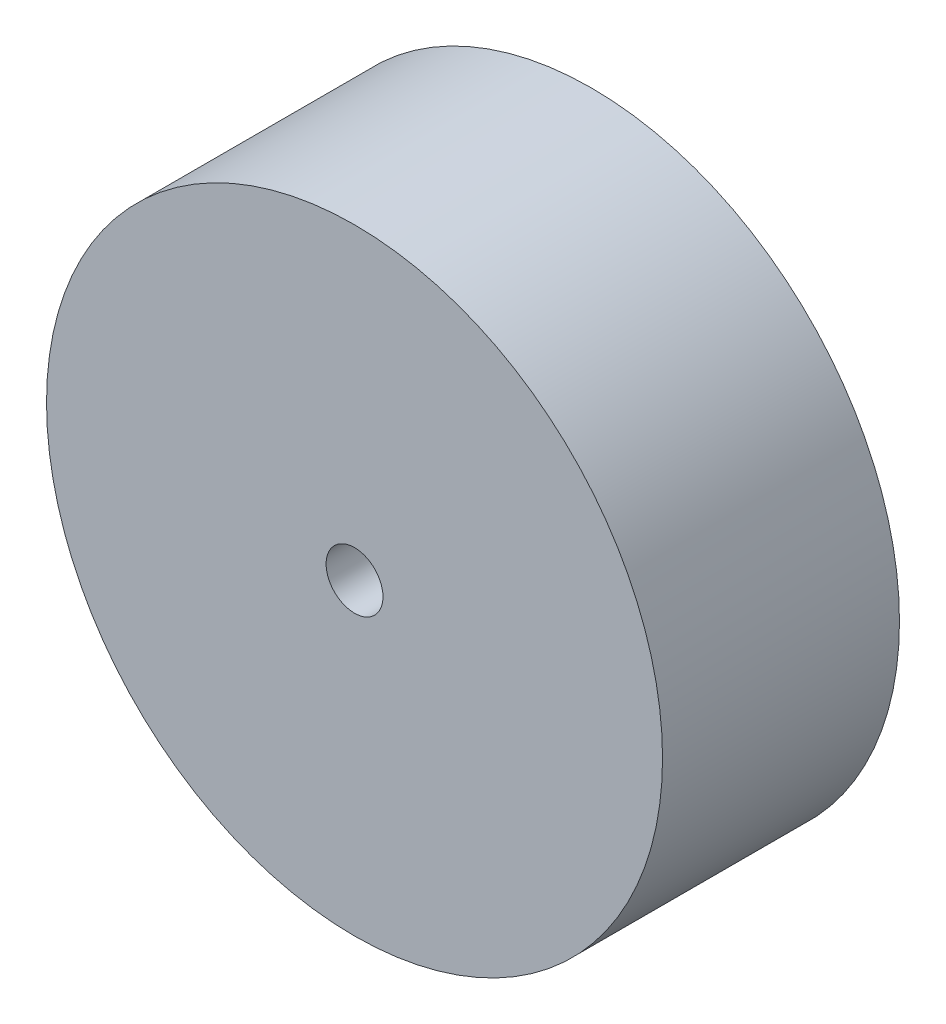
SolidWorks part; units mm, degrees
ref_plane "Plan de face" through (0, 0, 0) normal (0, 0, 1) x (1, 0, 0)
ref_plane "Plan de dessus" through (0, 0, 0) normal (0, 1, 0) x (1, 0, 0)
ref_plane "Plan de droite" through (0, 0, 0) normal (1, 0, 0) x (0, 0, -1)
sketch "Esquisse1" plane through (0, 0, 0) normal (0, 0, 1) x (1, 0, 0)
  circle A0 centre (0, 0) radius 32.5
  circle A1 centre (0, 0) radius 3
  dimension "D1" = 65
  dimension "D2" = 6
extrude "Boss.-Extru.1" add sketch "Esquisse1" along normal blind 25 contours A0
